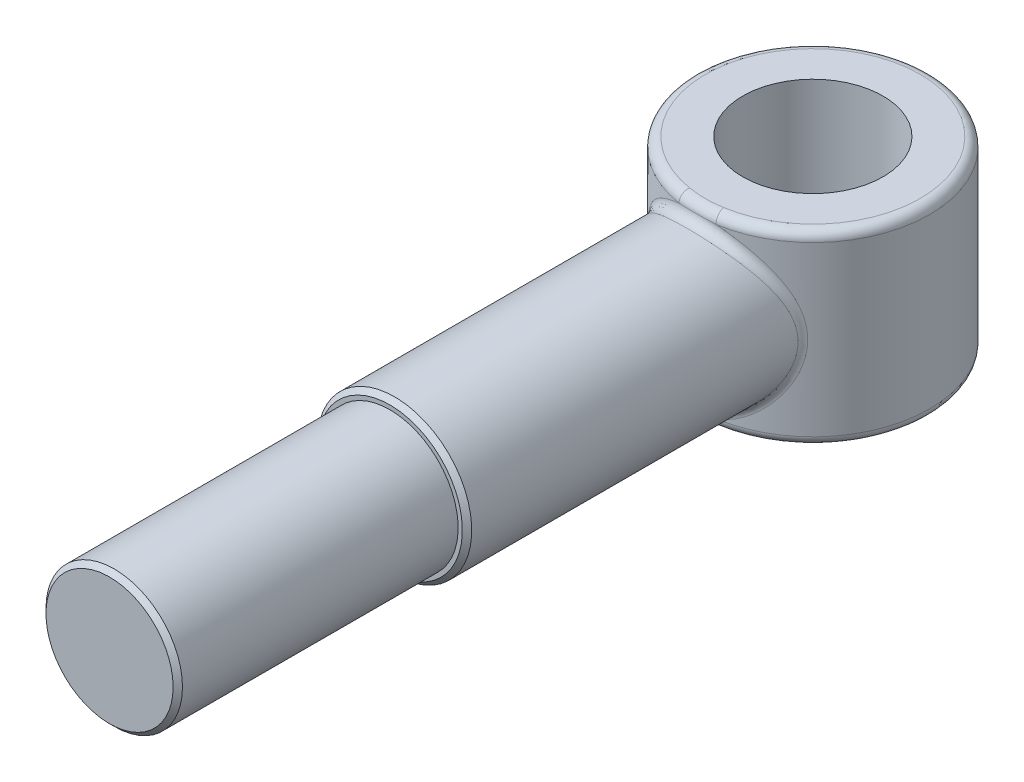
SolidWorks part; units mm, degrees
ref_plane "Plane1" through (0, 0, 0) normal (0, 0, 1) x (1, 0, 0)
ref_plane "Plane2" through (0, 0, 0) normal (0, 1, 0) x (1, 0, 0)
ref_plane "Plane3" through (0, 0, 0) normal (1, 0, 0) x (0, 0, -1)
sketch "Esquisse1" plane through (0, 0, 0) normal (0, 0, 1) x (1, 0, 0)
  circle A0 centre (0, 0) radius 14.6
  dimension "D1" = 29.2
extrude "Base-Extrusion" add sketch "Esquisse1" along normal blind 60
sketch "Esquisse2" plane through (0, 0, 0) normal (0, 0, -1) x (-1, 0, 0)
  circle A0 centre (0, 0) radius 16.5
  dimension "D1" = 33
extrude "Boss.-Extru.1" add sketch "Esquisse2" along normal blind 75
sketch "Esquisse3" plane through (0, 0, 0) normal (0, 1, 0) x (1, 0, 0)
  line L0 (0, -60) -> (0, 0) construction
  line L1 (-14.6, -60) -> (14.6, -60) construction
  circle A0 centre (0, 90.5) radius 25
  dimension "D2" = 50
  dimension "D1" = 150.5
extrude "Boss.-Extru.2" add sketch "Esquisse3" along normal mid plane 40
sketch "Esquisse4" plane through (0, 20, 0) normal (0, 1, 0) x (-1, 0, 0)
  circle A0 centre (0, -90.5) radius 15
  dimension "D1" = 30
extrude "Enlèv. mat.-Extru.1" cut sketch "Esquisse4" against normal through all
fillet "Congé1" radius 2
chamfer "Chanfrein2" distance 1 angle 45
fillet "Congé2" radius 2
